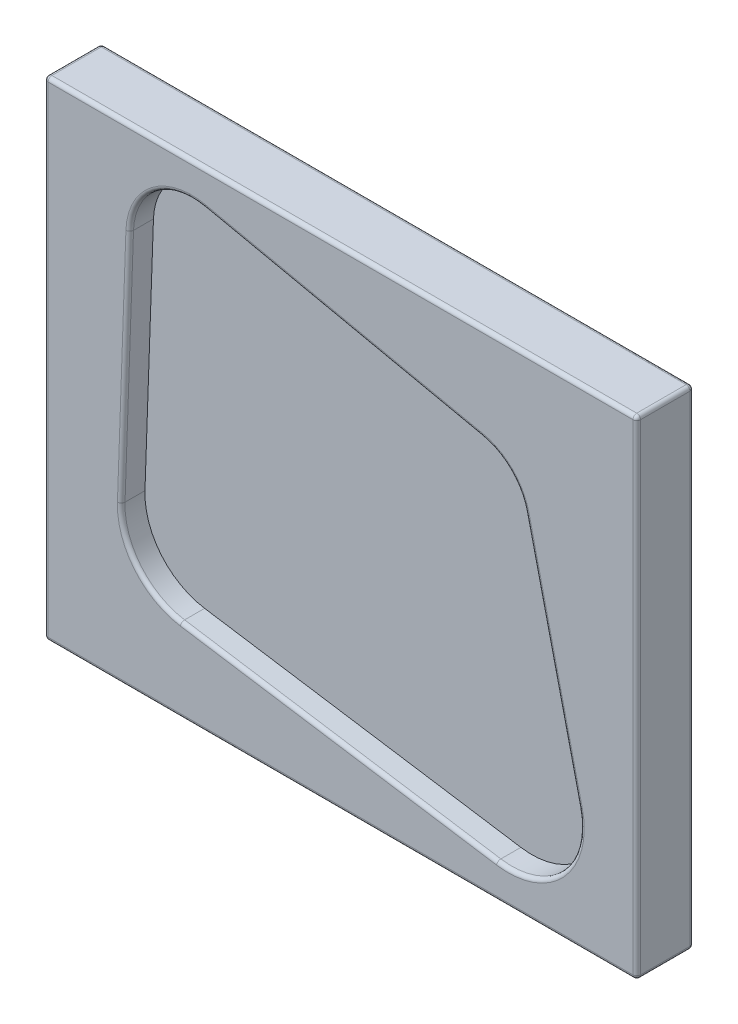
SolidWorks part; units mm, degrees
ref_plane "Front" through (0, 0, 0) normal (0, 0, 1) x (1, 0, 0)
ref_plane "Top" through (0, 0, 0) normal (0, 1, 0) x (1, 0, 0)
ref_plane "Right" through (0, 0, 0) normal (1, 0, 0) x (0, 0, -1)
sketch "Sketch1" plane through (0, 0, 0) normal (0, 0, 1) x (1, 0, 0)
  line L1 (128.8202, 771.7824) -> (921.0833, 771.7824)
  line L2 (128.8202, 771.7824) -> (128.8202, 118.7007)
  line L3 (128.8202, 118.7007) -> (921.0833, 118.7007)
  line L4 (921.0833, 771.7824) -> (921.0833, 118.7007)
extrude "Extrude1" add sketch "Sketch1" against normal blind 76.2
sketch "Sketch2" plane through (0, 0, 0) normal (0, 0, 1) x (1, 0, 0)
  line L12 (243.0525, 646.9505) -> (231.702, 326.5012)
  line L13 (311.4463, 230.0803) -> (734.3649, 164.7086)
  line L14 (843.2754, 282.1429) -> (771.9899, 588.469)
  line L15 (713.8724, 645.5764) -> (343.1925, 725.0137)
  line L16 (243.0525, 646.9505) -> (231.702, 326.5012)
  line L17 (311.4463, 230.0803) -> (734.3649, 164.7086)
  line L18 (843.2754, 282.1429) -> (771.9899, 588.469)
  line L19 (713.8724, 645.5764) -> (343.1925, 725.0137)
  arc A8 (343.1925, 725.0137) -> (243.0525, 646.9505) centre (325.835, 644.0183) ccw
  arc A9 (231.702, 326.5012) -> (311.4463, 230.0803) centre (325.835, 323.1669) ccw
  arc A10 (734.3649, 164.7086) -> (843.2754, 282.1429) centre (749.1306, 260.2344) ccw
  arc A11 (771.9899, 588.469) -> (713.8724, 645.5764) centre (697.9414, 571.2371) ccw
  arc A12 (343.1925, 725.0137) -> (243.0525, 646.9505) centre (325.835, 644.0183) ccw
  arc A13 (231.702, 326.5012) -> (311.4463, 230.0803) centre (325.835, 323.1669) ccw
  arc A14 (734.3649, 164.7086) -> (843.2754, 282.1429) centre (749.1306, 260.2344) ccw
  arc A15 (771.9899, 588.469) -> (713.8724, 645.5764) centre (697.9414, 571.2371) ccw
  dimension "D1" = 2.54
extrude "Cut-Extrude1" cut sketch "Sketch2" against normal blind 31.75
fillet "Fillet1" radius 5.08 20 edges at (128.8202, 445.2416, -76.2) (524.9517, 118.7007, -76.2) (128.8202, 118.7007, -38.1) (524.9517, 118.7007, 0) (128.8202, 445.2416, 0) (237.3772, 486.7258, 0) (253.2507, 263.1364, 0) (522.9056, 197.3944, 0) (820.0035, 194.5058, 0) (807.6326, 435.3059, 0) (751.2274, 625.4656, 0) (528.5324, 685.295, 0) (274.9079, 709.348, 0) (921.0833, 445.2416, -76.2) (921.0833, 118.7007, -38.1) (921.0833, 445.2416, 0) (128.8202, 771.7824, -38.1) (524.9517, 771.7824, -76.2) (921.0833, 771.7824, -38.1) (524.9517, 771.7824, 0)
